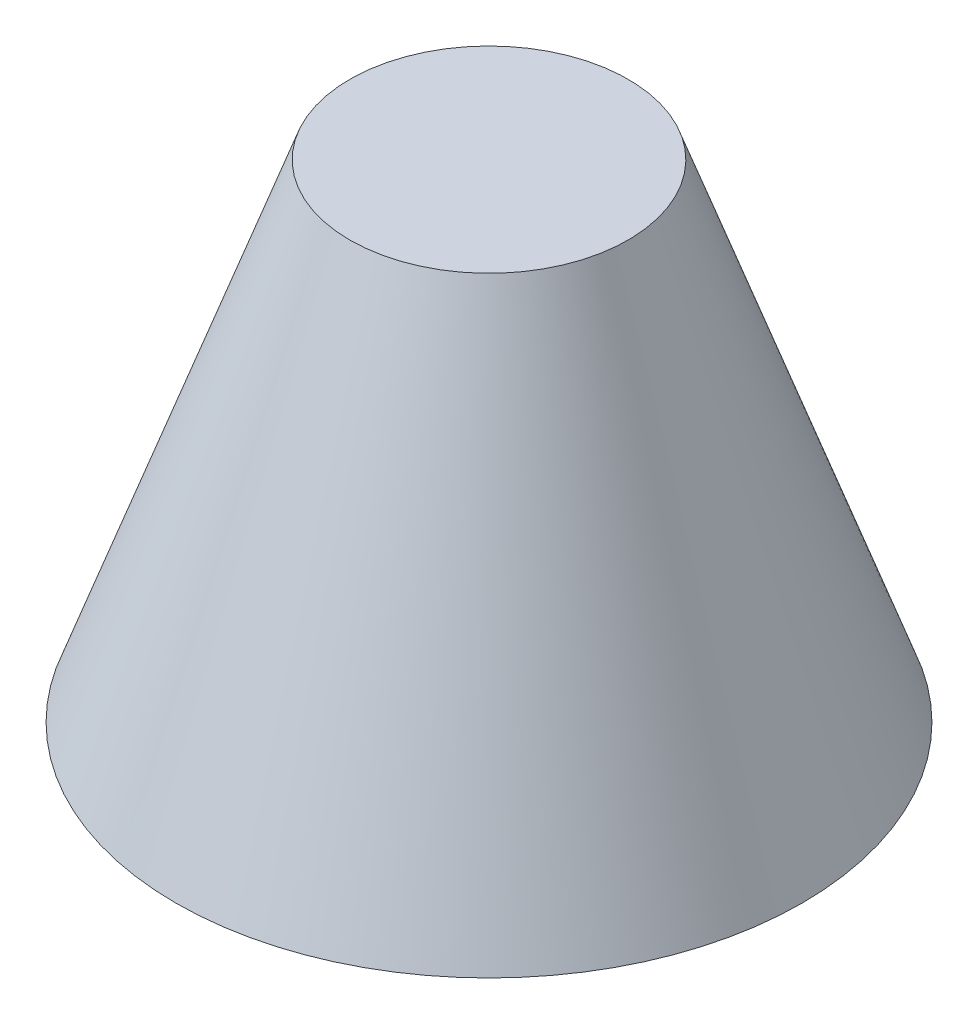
SolidWorks part; units mm, degrees
ref_plane "前视基准面" through (0, 0, 0) normal (0, 0, 1) x (1, 0, 0)
ref_plane "上视基准面" through (0, 0, 0) normal (0, 1, 0) x (1, 0, 0)
ref_plane "右视基准面" through (0, 0, 0) normal (1, 0, 0) x (0, 0, -1)
sketch "草图1" plane through (0, 0, 0) normal (1, 0, 0) x (0, 0, -1)
  line L0 (0, 90.5724) -> (0, -35.6597) construction
  line L1 (0, 70) -> (20, 70)
  line L2 (20, 70) -> (45, 0)
  line L3 (45, 0) -> (0, 0)
  line L4 (0, 0) -> (0, 70)
  dimension "D1" = 45
  dimension "D2" = 20
  dimension "D3" = 70
revolve "旋转1" add sketch "草图1" angle 360 about L0
